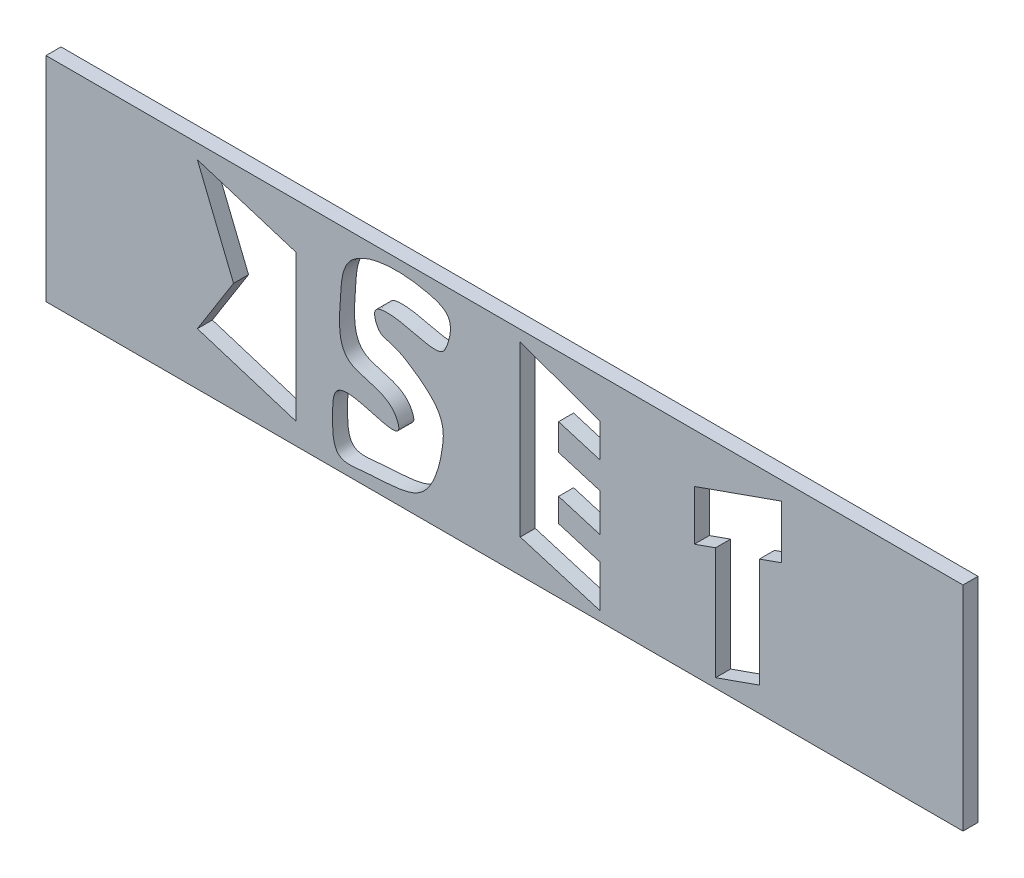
SolidWorks part; units mm, degrees
ref_plane "Plan de face" through (0, 0, 0) normal (0, 0, 1) x (1, 0, 0)
ref_plane "Plan de dessus" through (0, 0, 0) normal (0, 1, 0) x (1, 0, 0)
ref_plane "Plan de droite" through (0, 0, 0) normal (1, 0, 0) x (0, 0, -1)
sketch "Esquisse1" plane through (0, 0, 0) normal (0, 0, 1) x (1, 0, 0)
  line L0 (112.29, 122.18) -> (171.59, 103.63)
  line L1 (0, 0) -> (590, 0)
  line L2 (0, 0) -> (0, 139)
  line L3 (0, 139) -> (590, 139)
  line L4 (590, 0) -> (590, 139)
  line L5 (171.59, 103.63) -> (171.59, 15.82)
  line L6 (171.59, 15.82) -> (112.29, 34.38)
  line L7 (112.29, 34.38) -> (134, 68.79)
  line L8 (134, 68.79) -> (112.29, 122.18)
  line L9 (354, 106.92) -> (306, 124.42)
  line L10 (306, 124.42) -> (306, 23)
  line L11 (306, 23) -> (354, 8.6)
  line L12 (354, 8.6) -> (354, 33.92)
  line L13 (354, 33.92) -> (329, 41.42)
  line L14 (329, 41.42) -> (329, 55.62)
  line L15 (329, 55.62) -> (354, 48.12)
  line L16 (354, 48.12) -> (354, 70.92)
  line L17 (354, 70.92) -> (329, 78.42)
  line L18 (329, 78.42) -> (329, 94.42)
  line L19 (329, 94.42) -> (354, 86.92)
  line L20 (354, 86.92) -> (354, 106.92)
  line L21 (410.4742, 101.5) -> (462.7914, 120)
  line L22 (462.7914, 120) -> (462.7914, 88)
  line L23 (462.7914, 88) -> (449.5, 83.3)
  line L24 (449.5, 83.3) -> (449.5, 17.8)
  line L25 (449.5, 17.8) -> (423.2, 8.5)
  line L26 (423.2, 8.5) -> (423.2, 76)
  line L27 (423.2, 76) -> (410.4742, 71.5)
  line L28 (410.4742, 71.5) -> (410.4742, 101.5)
  spline S0 degree 3 poles (267.6719, 116.9197) (240.2959, 125.9914) (209.832, 124.7942) (199.3878, 110.7545) (197.0011, 79.0117) (195.4441, 57.86) (227.7252, 58.0917) (238.7128, 31.2574) (193.8425, 56.9885) (193.2497, 28.3581) (193.4144, 7.179) (221.1568, 11.8813) (250.6756, 9.4836) (262.1056, 52.0392) (259.8494, 66.2444) (227.652, 87.0164) (221.7916, 82.3552) (217.0506, 98.6347) (236.8261, 101.7805) (257.1375, 89.9518) (262.907, 102.0131) (267.6719, 116.9197) (240.2959, 125.9914) (209.832, 124.7942) knots -0.073147 -0.073147 -0.034387 0 0.0984 0.148759 0.148759 0.237267 0.301598 0.317592 0.401495 0.435731 0.482087 0.518804 0.599047 0.669356 0.762623 0.762623 0.810519 0.828888 0.845073 0.926853 0.926853 0.965613 1 1.0984 1.148759 1.148759 only from (250.4511, 122.0772) to (250.4511, 122.0772)
  dimension "D1" = 590
  dimension "D2" = 139
  dimension "D3" = 112.29
  dimension "D4" = 171.59
  dimension "D5" = 134
  dimension "D6" = 112.29
  dimension "D7" = 15.82
  dimension "D8" = 34.38
  dimension "D9" = 68.79
  dimension "D10" = 122.18
  dimension "D11" = 103.63
  dimension "D12" = 140.5
  dimension "D13" = 166.8
  dimension "D14" = 17.8
  dimension "D15" = 8.5
  dimension "D16" = 76
  dimension "D17" = 71.5
  dimension "D18" = 101.5
  dimension "D19" = 120
  dimension "D20" = 88
  dimension "D21" = 8.6
  dimension "D22" = 236
  dimension "D23" = 23
  dimension "D24" = 48
  dimension "D25" = 25.32
  dimension "D26" = 25
  dimension "D27" = 14.2
  dimension "D28" = 22.8
  dimension "D29" = 16
  dimension "D30" = 20
  dimension "D31" = 17.5
extrude "Extrusion1" add sketch "Esquisse1" along normal blind 9
sketch "Esquisse2" plane through (0, 0, 9) normal (0, 0, 1) x (1, 0, 0)
  line L1 (21.4878, 130.8925) -> (571.6278, 130.8925)
  line L2 (21.4878, 130.8925) -> (21.4878, 2.9925)
  line L3 (21.4878, 2.9925) -> (571.6278, 2.9925)
  line L4 (571.6278, 130.8925) -> (571.6278, 2.9925)
  dimension "D1" = 550.14
  dimension "D2" = 127.9
extrude "Enlèv. mat.-Extru.1" cut sketch "Esquisse2" against normal blind 10 flip side to cut
